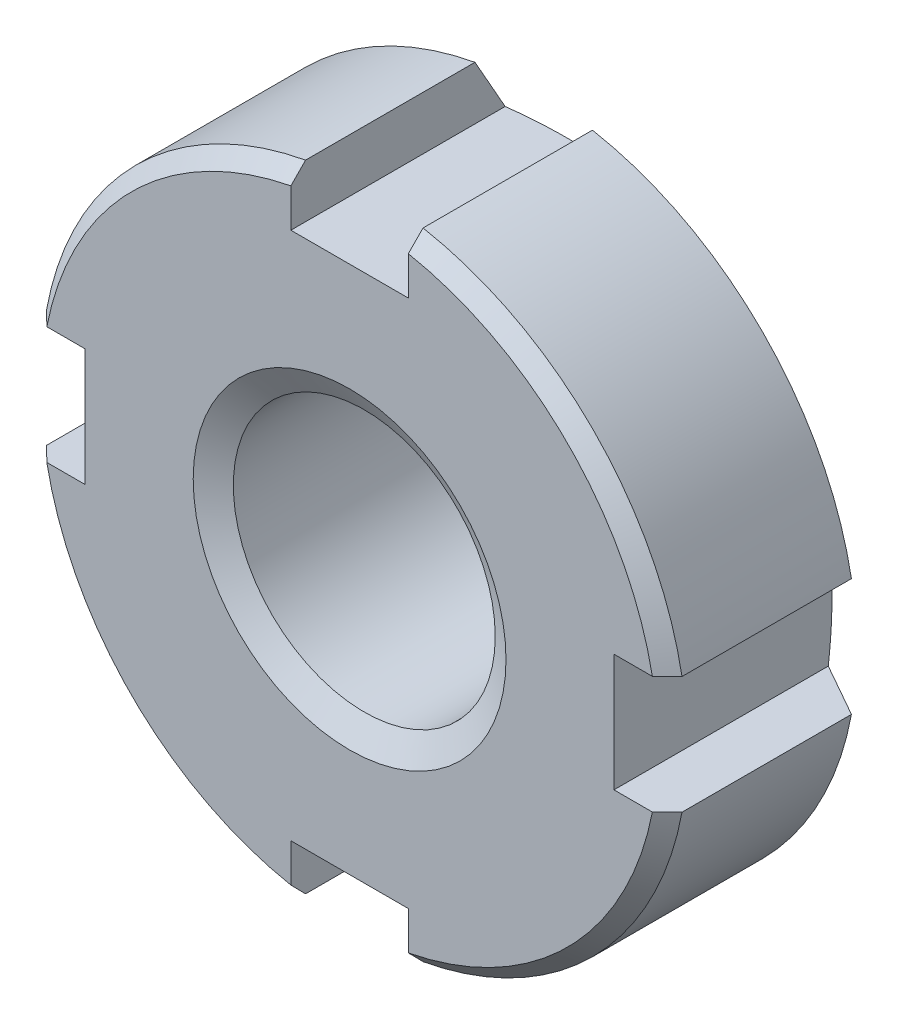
SolidWorks part; units mm, degrees
ref_plane "Front" through (0, 0, 0) normal (0, 0, 1) x (1, 0, 0)
ref_plane "Top" through (0, 0, 0) normal (0, 1, 0) x (1, 0, 0)
ref_plane "Right" through (0, 0, 0) normal (1, 0, 0) x (0, 0, -1)
sketch "Sketch1" plane through (0, 0, 0) normal (0, 0, 1) x (1, 0, 0)
  circle A0 centre (0, 0) radius 11
  circle A1 centre (0, 0) radius 4.4585
  dimension "dk" = 22
  dimension "D" = 8.917
extrude "BaseNut" add sketch "Sketch1" against normal blind 8
sketch "Sketch2" plane through (0, 0, 0) normal (0, 1, 0) x (1, 0, 0)
  line L0 (-11, 8) -> (-8, 8)
  line L2 (-8, 8) -> (-11, 6.2679)
  line L3 (-11, 6.2679) -> (-11, 8)
  line L4 (0, 4.5605) -> (0, -11.63) construction
  line L7 (11, 8) -> (-11, 8) construction
  line L8 (-11, 8) -> (-11, 0) construction
  dimension "d1" = 16
  dimension "Angle" = 30
revolve "StepCut" cut sketch "Sketch2" angle 360 about L4
chamfer "Chamfer1" distance 0.5 angle 45 1 edges at (11, 0, 0)
chamfer "EndChamfer" distance 0.5 angle 60 1 edges at (4.4585, 0, 0)
chamfer "Chamfer2" distance 0.7 angle 45 1 edges at (4.4585, 0, -8)
sketch "Sketch3" plane through (-3.5543, 4.131, -8) normal (0, 0, -1) x (-1, 0, 0)
  line L0 (-5.5543, -13.131) -> (-1.5543, -13.131)
  line L1 (-1.5543, -13.131) -> (-1.5543, -14.9477)
  line L3 (-5.5543, -14.9477) -> (-5.5543, -13.131)
  circle A0 centre (-3.5543, -4.131) radius 11 construction
  arc A1 (-5.5543, -14.9477) -> (-1.5543, -14.9477) centre (-3.5543, -4.131) ccw
  dimension "n1" = 2
  dimension "n" = 4
  dimension "t" = 2
extrude "SlotCut" cut sketch "Sketch3" against normal through all
pattern_circular "SlotPat" count 4 over 360 about axis through (0, 0, -4.5605) along (0, 0, 1) of "SlotCut"
sketch "Sketch4" plane through (0, 0, 0) normal (1, 0, 0) x (0, 0, -1)
  line L0 (16.8557, 0) -> (-7.8489, 0) construction
  line L1 (7.0293, 3.917) -> (7.5708, 3.917)
  line L2 (7.5708, 3.917) -> (7.5708, 4.4585)
  line L3 (7.5708, 4.4585) -> (7.3, 4.9275)
  line L4 (7.3, 4.9275) -> (7.0293, 4.4585)
  line L5 (7.0293, 4.4585) -> (7.0293, 3.917)
  line L6 (7.3, -4.4585) -> (7.3, 4.4585) construction
  dimension "D1" = 0.5415
  dimension "D2" = 8.917
revolve "Cut-Revolve10" [suppressed] cut sketch "Sketch4" angle 360 about L0
pattern_linear "LPattern10" [suppressed] count 12 spacing 0.6498 along (0, 0, 1)
equation "\"n1@Sketch3\" = \"n@Sketch3\" / 2"
equation "\"D1@Chamfer2\" = \"C1@EndChamfer\" * 1.4"
equation "\"D1@Sketch4\" = (  \"D2@ThreadCosmetic1\" - \"D@Sketch1\" )  / 2"
equation "\"D2@Sketch4\" = \"D@Sketch1\""
equation "\"D3@LPattern10\" = \"D1@Sketch4\" * 1.2"
equation "\"D1@LPattern10\" = \"m@BaseNut\" / \"D3@LPattern10\""
